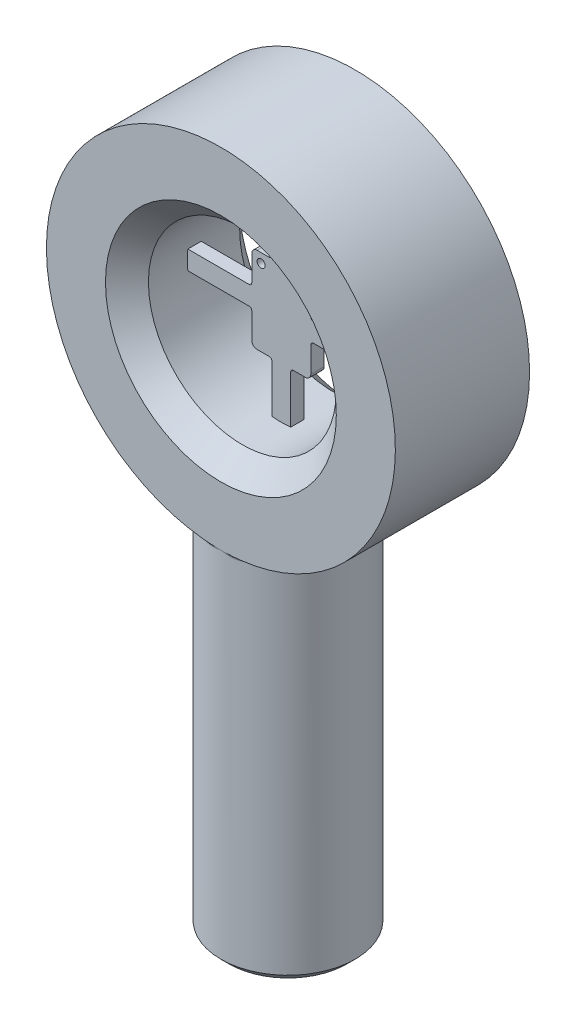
SolidWorks part; units mm, degrees
ref_plane "前视基准面" through (0, 0, 0) normal (0, 0, 1) x (1, 0, 0)
ref_plane "上视基准面" through (0, 0, 0) normal (0, 1, 0) x (1, 0, 0)
ref_plane "右视基准面" through (0, 0, 0) normal (1, 0, 0) x (0, 0, -1)
sketch "草图1" plane through (0, 0, 0) normal (0, 0, 1) x (1, 0, 0)
  line L0 (0, -4612.2947) -> (0, 226002.4423) construction
  circle A0 centre (0, 200) radius 65
  circle A1 centre (0, 200) radius 35
  dimension "D1" = 70
  dimension "D2" = 130
  dimension "D3" = 200
extrude "凸台-拉伸1" add sketch "草图1" along normal mid plane 50
sketch "草图2" plane through (0, 0, 0) normal (0, 1, 0) x (1, 0, 0)
  circle A0 centre (0, 0) radius 25
extrude "凸台-拉伸2" add sketch "草图2" along normal up to next
fillet "圆角2" radius 1 2 edges at (24.8719, 139.9468, -2.5272) (-24.9128, 139.9637, 2.0863)
sketch "草图3" plane through (0, 0, 0) normal (0, 0, 1) x (1, 0, 0)
  line L0 (-3.5, 184) -> (3.5, 184) construction
  line L1 (-11, 216) -> (11, 216) construction
  line L2 (-11, 216) -> (-11, 184) construction
  line L3 (-11, 184) -> (11, 184) construction
  line L4 (11, 216) -> (11, 184) construction
  line L5 (-11, 216) -> (11, 184) construction
  line L6 (-11, 184) -> (11, 216) construction
  line L7 (-3.5, 184) -> (-3.5, 140.605)
  line L8 (3.5, 184) -> (3.5, 140.605)
  line L9 (-3.5, 140.605) -> (3.5, 140.605)
  line L10 (-11, 184) -> (-3.5, 184)
  line L11 (3.5, 184) -> (11, 184)
  line L12 (-11, 216) -> (-3.5, 216)
  line L13 (-3.5, 216) -> (3.5, 216) construction
  line L14 (-3.5, 216) -> (-3.5, 243.0289)
  line L15 (-3.5, 243.0289) -> (3.5, 243.0289)
  line L16 (3.5, 216) -> (3.5, 243.0289)
  line L17 (3.5, 216) -> (11, 216)
  line L18 (-11, 216) -> (-11, 203.5)
  line L19 (-11, 203.5) -> (-39.8482, 203.5)
  line L20 (-11, 203.5) -> (-11, 196.5) construction
  line L21 (-11, 196.5) -> (-39.8482, 196.5)
  line L22 (-39.8482, 203.5) -> (-39.8482, 196.5)
  line L23 (11, 203.5) -> (47.5136, 203.5)
  line L24 (11, 203.5) -> (11, 196.5) construction
  line L25 (11, 196.5) -> (47.5136, 196.5)
  line L26 (47.5136, 203.5) -> (47.5136, 196.5)
  line L27 (-11, 196.5) -> (-11, 184)
  line L28 (11, 184) -> (11, 196.5)
  line L29 (11, 203.5) -> (11, 216)
  line L30 (0, -1000) -> (0, 49000) construction
  line L31 (-1000, 200) -> (49000, 200) construction
  circle A0 centre (0, 200) radius 35 construction
  point P0 (0, 200)
  point P6 (0, 184)
  point P15 (0, 216)
  point P16 (0, 243.0289)
  point P25 (-39.8482, 200)
  point P26 (47.5136, 200)
  dimension "D1" = 32
  dimension "D2" = 22
  dimension "D3" = 7
  dimension "D4" = 7
  dimension "D5" = 7
extrude "凸台-拉伸3" add sketch "草图3" along normal mid plane 5
fillet "圆角3" radius 2 4 edges at (11, 184, 0) (-11, 184, 0) (11, 216, 0) (-11, 216, 0)
fillet "圆角4" radius 1 8 edges at (3.5, 184, 0) (-3.5, 184, 0) (-3.5, 216, 0) (3.5, 216, 0) (-11, 196.5, 0) (-11, 203.5, 0) (11, 196.5, 0) (11, 203.5, 0)
chamfer "倒角1" distance 3 angle 45 1 edges at (0, 0, 25)
sketch "草图5" plane through (0, 0, 0) normal (0, 0, 1) x (1, 0, 0)
  line L0 (-988.5487, 80) -> (49011.4513, 80) construction
  dimension "D1" = 80
sketch "草图6" plane through (0, 0, 2.5) normal (0, 0, 1) x (1, 0, 0)
  line L0 (9, 216) -> (4.5, 216) construction
  line L1 (-7.5, 212.5) -> (7.5, 212.5) construction
  circle A0 centre (-7.5, 212.5) radius 1.5
  circle A1 centre (7.5, 212.5) radius 1.5
  point P4 (0, 212.5)
  dimension "D3" = 3
  dimension "D1" = 15
  dimension "D2" = 3.5
extrude "切除-拉伸1" cut sketch "草图6" against normal up to next
chamfer "倒角2" distance 8 angle 45 2 edges at (35, 200, 25) (35, 200, -25)
